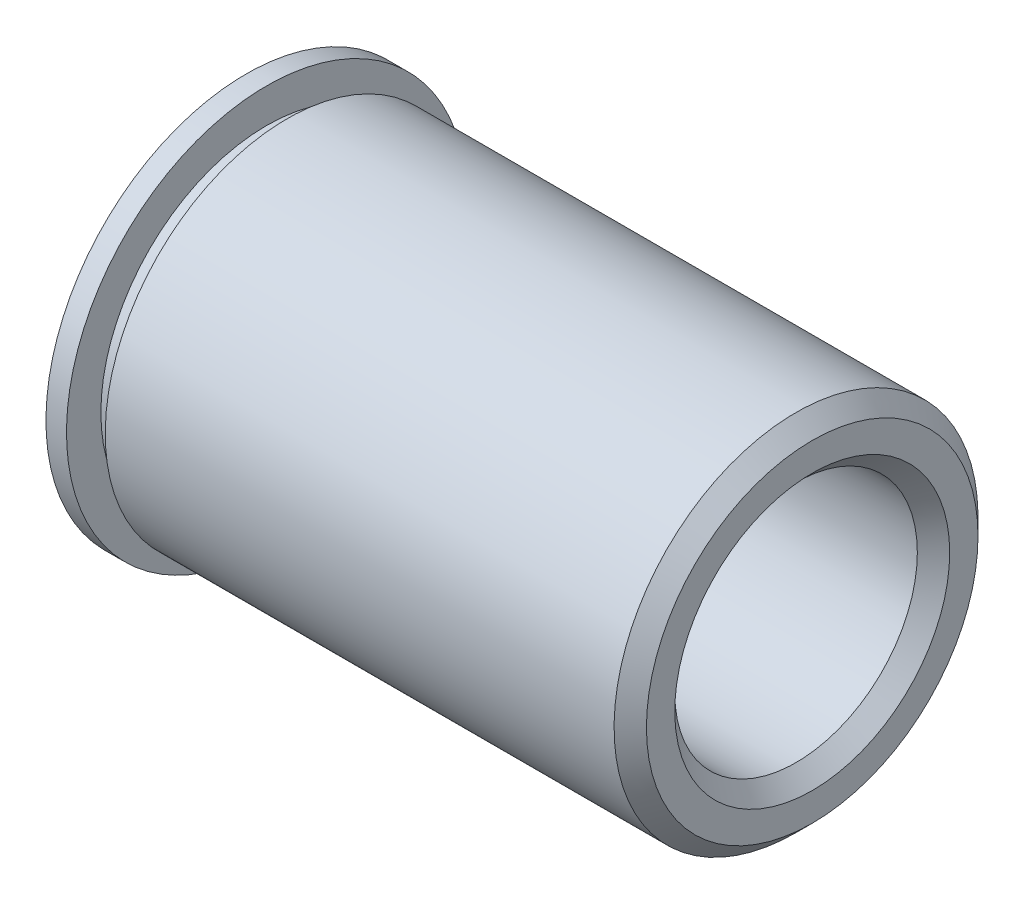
SolidWorks part; units mm, degrees
ref_plane "Front Plane" through (0, 0, 0) normal (0, 0, 1) x (1, 0, 0)
ref_plane "Top Plane" through (0, 0, 0) normal (0, 1, 0) x (1, 0, 0)
ref_plane "Right Plane" through (0, 0, 0) normal (1, 0, 0) x (0, 0, -1)
sketch "Sketch1" plane through (0, 0, 0) normal (0, 0, 1) x (1, 0, 0)
  line L0 (-67.8249, 0) -> (76.2137, 0) construction
  line L1 (76.2137, 0) -> (76.2137, 2.25)
  line L2 (76.2137, 2.25) -> (69.7217, 2.25)
  line L3 (69.7217, 2.25) -> (69.7217, 2.05)
  line L4 (69.7217, 2.05) -> (69.4677, 2.05)
  line L5 (69.4677, 2.05) -> (69.4677, 2.475)
  line L6 (69.4677, 2.475) -> (69.2137, 2.475)
  line L7 (69.2137, 2.475) -> (69.2137, 0)
  line L8 (69.2137, 0) -> (76.2137, 0)
  dimension "D1" = 2.25
  dimension "D2" = 7
  dimension "D3" = 0.254
  dimension "D4" = 0.254
  dimension "D5" = 0.2
  dimension "D6" = 2.475
revolve "Revolve1" add sketch "Sketch1" angle 360 about L0
sketch "Sketch2" plane through (76.2137, 0, 0) normal (1, 0, 0) x (0, 0, -1)
  circle A0 centre (0, 0) radius 1.5
  dimension "D1" = 3
extrude "Cut-Extrude1" cut sketch "Sketch2" against normal through all contours A0
chamfer "Chamfer1" distance 0.2 angle 45 1 edges at (76.2137, -2.25, 0)
chamfer "Chamfer2" distance 0.2 angle 45 2 edges at (69.2137, 0, -1.5) (76.2137, 0, -1.5)
